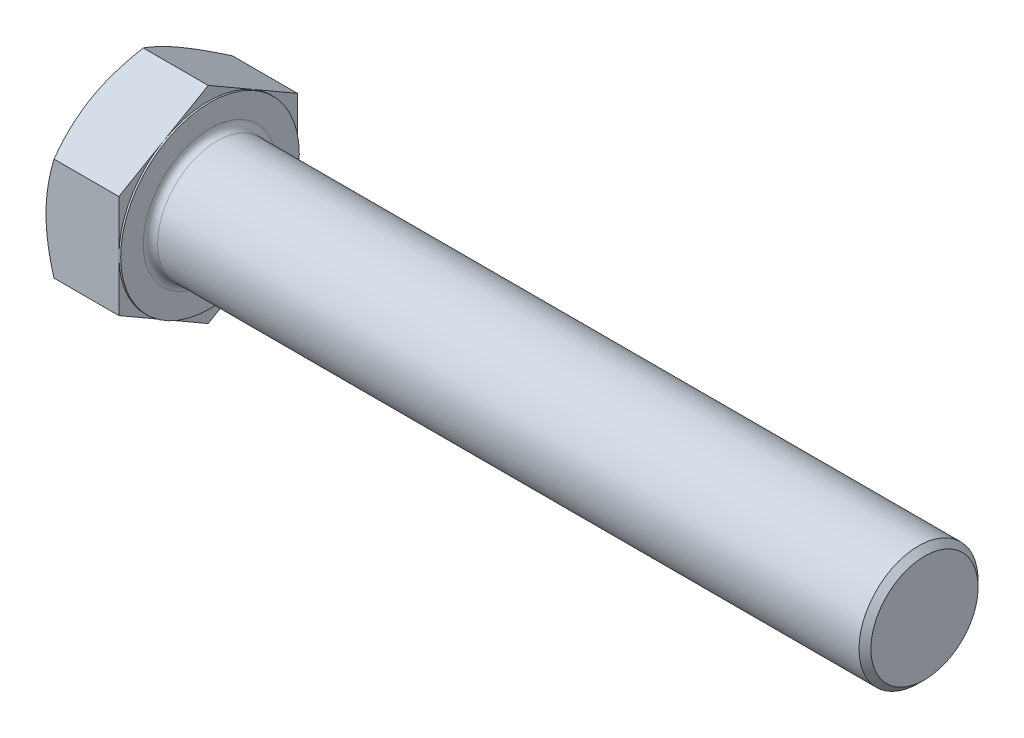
SolidWorks part; units mm, degrees
extrude "BaseHead" add sketch "Sketch1" along normal blind 15.9258
sketch "Sketch1" plane through (0, 0, 0) normal (1, 0, 0) x (0, 0, -1)
  line L0 (19.05, 10.9985) -> (19.05, -10.9985)
  line L1 (-19.05, 10.9985) -> (-19.05, -10.9985)
  line L2 (19.05, -10.9985) -> (0, -21.997)
  line L3 (0, -21.997) -> (-19.05, -10.9985)
  line L4 (19.05, 10.9985) -> (0, 21.997)
  line L5 (0, 21.997) -> (-19.05, 10.9985)
revolve "HeadChamfer" cut sketch "Sketch3" angle 360 about L6
sketch "Sketch3" plane through (0, 0, 0) normal (0, 0, 1) x (1, 0, 0)
  line L0 (0, 19.05) -> (5.3677, 28.347)
  line L1 (0, 21.997) -> (0, 10.9985) construction
  line L2 (5.3677, 28.347) -> (5.3677, 34.697)
  line L3 (5.3677, 34.697) -> (-12.7, 34.697)
  line L4 (-12.7, 34.697) -> (-12.7, 19.05)
  line L5 (-12.7, 19.05) -> (0, 19.05)
  line L6 (0, 0) -> (99.06, 0) construction
  line L7 (15.9258, 21.997) -> (0, 21.997) construction
ref_plane "Plane1" through (0, 0, 0) normal (0, 0, 1) x (1, 0, 0)
ref_plane "Plane2" through (0, 0, 0) normal (0, 1, 0) x (1, 0, 0)
ref_plane "Plane3" through (0, 0, 0) normal (1, 0, 0) x (0, 0, -1)
other "Configuration Table"
sketch "BodySke" plane through (0, 0, 0) normal (0, 0, 1) x (1, 0, 0)
  line L0 (0, 10.9985) -> (0, -10.9985) construction
  line L1 (0, 0) -> (168.3258, 0)
  line L2 (0, 0) -> (0, 12.7)
  line L3 (0, 12.7) -> (167.0571, 12.7)
  line L4 (168.3258, 0) -> (168.3258, 11.4313)
  line L5 (15.9258, 21.997) -> (15.9258, 10.9985) construction
  line L6 (168.3258, 11.4313) -> (167.0571, 12.7)
  line L7 (0, 0) -> (96.52, 0) construction
  line L8 (168.3258, -11.4313) -> (167.0571, -12.7) construction
  line L9 (0, -12.7) -> (167.0571, -12.7) construction
  line L10 (18.0416, 15.24) -> (18.0416, -1.27) construction
  line L11 (15.9258, 15.24) -> (15.9258, -1.27) construction
  line L12 (15.9258, 10.9985) -> (15.9258, -10.9985) construction
revolve "BaseBody" add sketch "BodySke" angle 360 about L7
sketch "Sketch4" plane through (0, 0, 0) normal (0, 0, 1) x (1, 0, 0)
  line L1 (15.9258, 21.997) -> (15.9258, 10.9985) construction
  line L2 (15.9258, 19.05) -> (15.5448, 19.05)
  line L3 (15.9258, 19.05) -> (15.9258, 47.397)
  line L4 (15.9258, 47.397) -> (15.5448, 47.397)
  line L5 (0, 0) -> (95.25, 0) construction
  line L6 (0, 0) -> (96.52, 0) construction
  line L7 (15.5448, 19.05) -> (15.5448, 47.397)
  line L8 (15.9258, 21.997) -> (1.7015, 21.997) construction
revolve "BearingFace" cut sketch "Sketch4" angle 360 about L5
fillet "HeadFillet" radius 1.524 1 edges at (15.9258, 0, -12.7)
sketch "ThdSchSke" plane through (0, 0, 0) normal (0, 0, 1) x (1, 0, 0)
  line L0 (18.0416, -11.4313) -> (17.1532, -12.7)
  line L1 (18.0416, -11.4313) -> (18.93, -12.7)
  line L2 (18.93, -12.7) -> (18.93, -15.875)
  line L3 (-3.175, 0) -> (5.1513, 0) construction
  line L5 (18.93, -15.875) -> (17.1532, -15.875)
  line L6 (17.1532, -15.875) -> (17.1532, -12.7)
revolve "ThreadSchematic" [suppressed] cut sketch "ThdSchSke" angle 360 about L3
pattern_linear "ThdSchPat" [suppressed]
equation "\"D3@Sketch1\" = \"Width_flats@Sketch1\" / 2"
equation "\"D4@Sketch1\" = \"D3@Sketch1\""
equation "\"D5@Sketch1\" = \"D4@Sketch1\""
equation "\"Thread_minor@ThreadCosmetic\" = \"Minor_dia@BodySke\""
equation "\"D1@Sketch3\" = \"Width_flats@Sketch1\" / 2"
equation "\"D1@Sketch4\" = \"Width_flats@Sketch1\" / 2"
equation "\"Thread_length@ThreadCosmetic\" = ((sgn( (\"Length@BodySke\" - \"Advance@BodySke\" ) - \"Thread_nom@BodySke\" )-1)*( (\"Length@BodySke\" - \"Advance@BodySke\" ) - \"Thread_nom@BodySke\" ))/-2+ \"Thread_nom@BodySke\""
equation "\"Thread_minor@ThdSchSke\" = \"Minor_dia@BodySke\""
equation "\"Diameter@ThdSchSke\" = \"Diameter@BodySke\""
equation "\"Overcut@ThdSchSke\" = \"Diameter@BodySke\" * 1.25"
equation "\"Start@ThdSchSke\" = \"Head_ht@BaseHead\" + \"Length@BodySke\" - \"Thread_length@ThreadCosmetic\"  '---Non-countersunk---"
equation "\"Num_threads@ThdSchPat\" = int( \"Thread_length@ThreadCosmetic\" / \"Advance@BodySke\" + 0.999 )  + 1"
equation "\"Advance@ThdSchPat\" = \"Thread_length@ThreadCosmetic\" /  (\"Num_threads@ThdSchPat\" - 1) 'relax it"
equation "\"Num_threads@ThdSchPat\" = \"Num_threads@ThdSchPat\" - sgn( \"Num_threads@ThdSchPat\" - 1) '---chamfered tips only---"
